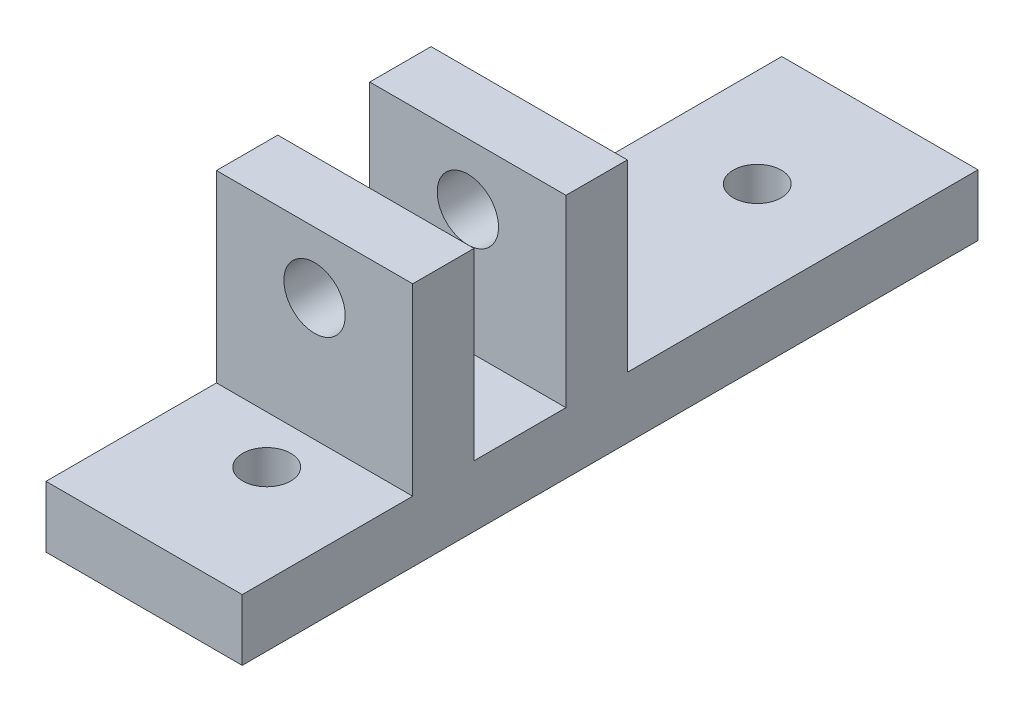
SolidWorks part; units mm, degrees
ref_plane "Front" through (0, 0, 0) normal (0, 0, 1) x (1, 0, 0)
ref_plane "Top" through (0, 0, 0) normal (0, 1, 0) x (1, 0, 0)
ref_plane "Right" through (0, 0, 0) normal (1, 0, 0) x (0, 0, -1)
sketch "Sketch1" plane through (0, 0, 0) normal (0, 0, 1) x (1, 0, 0)
  line L1 (0, 0) -> (20.32, 0)
  line L2 (0, 0) -> (0, 25.4)
  line L3 (0, 25.4) -> (20.32, 25.4)
  line L4 (20.32, 0) -> (20.32, 25.4)
  dimension "D1" = 20.32
  dimension "D2" = 25.4
extrude "Boss-Extrude1" add sketch "Sketch1" along normal blind 76.2
sketch "Sketch2" plane through (0, 25.4, 0) normal (0, 1, 0) x (1, 0, 0)
  line L0 (0, 0) -> (0, -76.2) construction
  line L1 (0, 50.8) -> (20.32, 50.8)
  line L2 (0, 50.8) -> (0, -36.322)
  line L3 (0, -36.322) -> (20.32, -36.322)
  line L4 (20.32, 50.8) -> (20.32, -36.322)
  line L5 (20.32, 0) -> (20.32, -76.2) construction
  line L7 (0, -42.672) -> (20.32, -42.672)
  line L8 (0, -42.672) -> (0, -52.197)
  line L9 (0, -52.197) -> (20.32, -52.197)
  line L10 (20.32, -42.672) -> (20.32, -52.197)
  line L11 (0, -58.547) -> (20.32, -58.547)
  line L12 (0, -58.547) -> (0, -76.2)
  line L13 (0, -76.2) -> (20.32, -76.2)
  line L14 (20.32, -58.547) -> (20.32, -76.2)
  dimension "D1" = 9.525
  dimension "D2" = 6.35
  dimension "D3" = 6.35
  dimension "D4" = 24.003
extrude "Cut-Extrude1" cut sketch "Sketch2" against normal blind 19.05
sketch "Sketch3" plane through (0, 0, 58.547) normal (0, 0, 1) x (1, 0, 0)
  line L0 (10.16, 0) -> (10.16, 19.05) construction
  line L1 (0, 0) -> (20.32, 0) construction
  circle A0 centre (10.16, 19.05) radius 3.175
  dimension "D1" = 6.35
  dimension "D2" = 19.05
extrude "Cut-Extrude2" cut sketch "Sketch3" against normal through all
sketch "Sketch4" plane through (0, 0, 0) normal (0, -1, 0) x (1, 0, 0)
  line L0 (10.16, 76.2) -> (10.16, 0) construction
  line L1 (0, 76.2) -> (20.32, 76.2) construction
  line L2 (0, 0) -> (20.32, 0) construction
  circle A0 centre (10.16, 63.5) radius 2.4892
  circle A1 centre (10.16, 12.7) radius 2.4892
  circle A2 centre (10.16, 38.1) radius 2.4892 construction
  dimension "D3" = 4.9784
  dimension "D4" = 25.4
  dimension "D1" = 12.7
  dimension "D2" = 12.7
extrude "Cut-Extrude3" cut sketch "Sketch4" against normal blind 19.05
